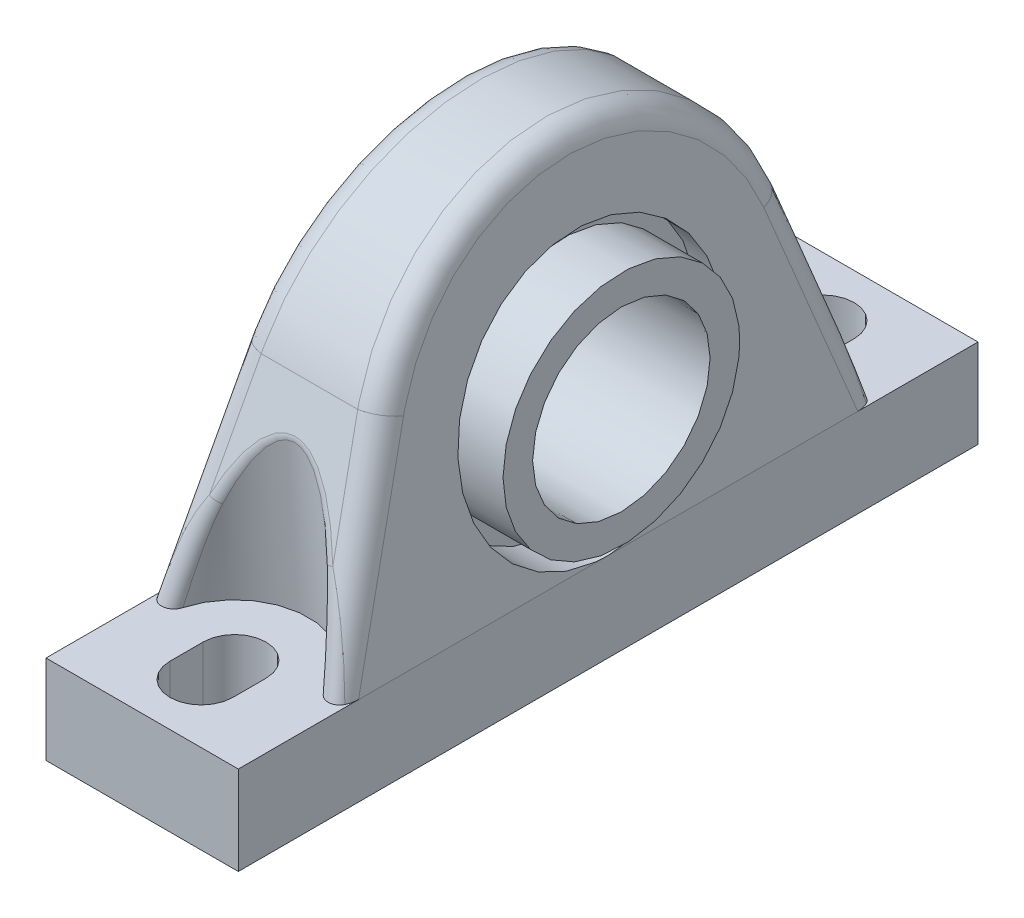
SolidWorks part; units mm, degrees
ref_plane "front" through (0, 0, 0) normal (0, 0, 1) x (1, 0, 0)
ref_plane "top" through (0, 0, 0) normal (0, 1, 0) x (1, 0, 0)
ref_plane "side" through (0, 0, 0) normal (1, 0, 0) x (0, 0, -1)
sketch "Sketch1" plane through (0, 0, 0) normal (1, 0, 0) x (0, 0, -1)
  line L0 (0, 0) -> (0, 89.4558) construction
  line L1 (-79.375, 0) -> (79.375, 0)
  line L2 (79.375, 0) -> (79.375, 19.05)
  line L3 (79.375, 19.05) -> (58.7375, 19.05)
  line L4 (58.7375, 19.05) -> (43.4651, 62.7985)
  line L5 (-58.7375, 19.05) -> (-43.4651, 62.7985)
  line L6 (-79.375, 19.05) -> (-58.7375, 19.05)
  line L7 (-79.375, 0) -> (-79.375, 19.05)
  arc A0 (43.4651, 62.7985) -> (-43.4651, 62.7985) centre (0, 47.625) ccw
  point P12 (0, 0)
  dimension "D1" = 158.75
  dimension "D2" = 93.6625
  dimension "D3" = 47.625
  dimension "D4" = 19.05
  dimension "D5" = 117.475
extrude "Base-Extrude" add sketch "Sketch1" along normal mid plane 41.275
sketch "Sketch3" plane through (0, 0, 79.375) normal (0, 0, 1) x (1, 0, 0)
  line L0 (20.6375, 19.05) -> (11.4762, 93.6625)
  line L1 (20.6375, 93.6625) -> (-20.6375, 93.6625) construction
  line L2 (11.4762, 93.6625) -> (20.6375, 93.6625)
  line L3 (20.6375, 62.7985) -> (20.6375, 93.6625) construction
  line L4 (20.6375, 93.6625) -> (20.6375, 19.05)
  dimension "D1" = 7
extrude "Cut-Extrude1" cut sketch "Sketch3" against normal through all
mirror "Mirror1" about plane through (0, 0, 0) normal (1, 0, 0) of "Cut-Extrude1"
sketch "Sketch4" plane through (0, 0, 0) normal (1, 0, 0) x (0, 0, -1)
  circle A0 centre (0, 47.625) radius 25.4
  dimension "D1" = 50.8
extrude "Boss-Extrude2" add sketch "Sketch4" along normal blind 23.4696
sketch "Sketch5" plane through (23.4696, 0, 0) normal (1, 0, 0) x (0, 0, -1)
  circle A0 centre (0, 47.625) radius 28.575
  circle A1 centre (0, 47.625) radius 25.4
  circle A2 centre (0, 47.625) radius 25.4
  dimension "D2" = 57.15
  dimension "D1" = 0
extrude "Cut-Extrude2" cut sketch "Sketch5" against normal blind 12.7
sketch "Sketch6" plane through (23.4696, 0, 0) normal (1, 0, 0) x (0, 0, -1)
  circle A0 centre (0, 47.625) radius 19.05
  dimension "D1" = 38.1
extrude "Cut-Extrude3" cut sketch "Sketch6" against normal through all
sketch "Sketch7" plane through (-20.6375, 0, 0) normal (-1, 0, 0) x (0, 0, 1)
  circle A0 centre (0, 47.625) radius 25.4 construction
  arc A1 (28.575, 47.625) -> (28.575, 47.625) centre (0, 47.625) ccw
  circle A2 centre (0, 47.625) radius 28.575
  circle A3 centre (0, 47.625) radius 25.4
  dimension "D1" = 0
extrude "Cut-Extrude4" cut sketch "Sketch7" against normal blind 9.525
sketch "Sketch8" plane through (0, 0, 0) normal (0, -1, 0) x (1, 0, 0)
  line L0 (0, -79.375) -> (0, 79.375) construction
  line L1 (20.6375, -79.375) -> (-20.6375, -79.375) construction
  line L2 (20.6375, 79.375) -> (-20.6375, 79.375) construction
  line L3 (6.7437, -59.5312) -> (6.7437, -66.675)
  line L4 (-6.7437, -59.5312) -> (-6.7437, -66.675)
  line L5 (0, 0) -> (43.4591, 0) construction
  line L6 (-6.7437, 59.5312) -> (-6.7437, 66.675)
  line L7 (6.7437, 59.5312) -> (6.7437, 66.675)
  arc A0 (6.7437, -66.675) -> (-6.7437, -66.675) centre (0, -66.675) cw
  arc A1 (6.7437, -59.5312) -> (-6.7437, -59.5312) centre (0, -59.5312) ccw
  arc A3 (6.7437, 59.5312) -> (-6.7437, 59.5312) centre (0, 59.5312) cw
  arc A5 (6.7437, 66.675) -> (-6.7437, 66.675) centre (0, 66.675) ccw
  dimension "D1" = 119.0625
  dimension "D2" = 133.35
  dimension "D3" = 13.4874
extrude "Cut-Extrude5" cut sketch "Sketch8" against normal through all
sketch "Sketch9" plane through (0, 19.05, 0) normal (0, 1, 0) x (-1, 0, 0)
  circle A0 centre (0, 59.5313) radius 15.875
  circle A2 centre (0, -59.5312) radius 15.875
  dimension "D1" = 31.75
extrude "Cut-Extrude6" cut sketch "Sketch9" along normal through all draft 5
fillet "Fillet1" radius 5.08 12 edges at (-18.2463, 19.05, 58.7375) (0, 53.5938, 46.6784) (18.2463, 19.05, 58.7375) (18.2463, 19.05, -58.7375) (-18.2463, 19.05, -58.7375) (0, 53.5938, -46.6784) (17.9517, 40.9242, 51.1013) (17.9517, 40.9242, -51.1013) (11.4762, 93.6625, 0) (-17.9517, 40.9242, -51.1013) (-11.4762, 93.6625, 0) (-17.9517, 40.9242, 51.1013)
fillet "Fillet3" radius 2.54 8 edges at (0, 53.5938, -46.6784) (0, 53.5938, 46.6784) (19.2552, 19.05, -57.1894) (-19.2552, 19.05, 57.1894)
